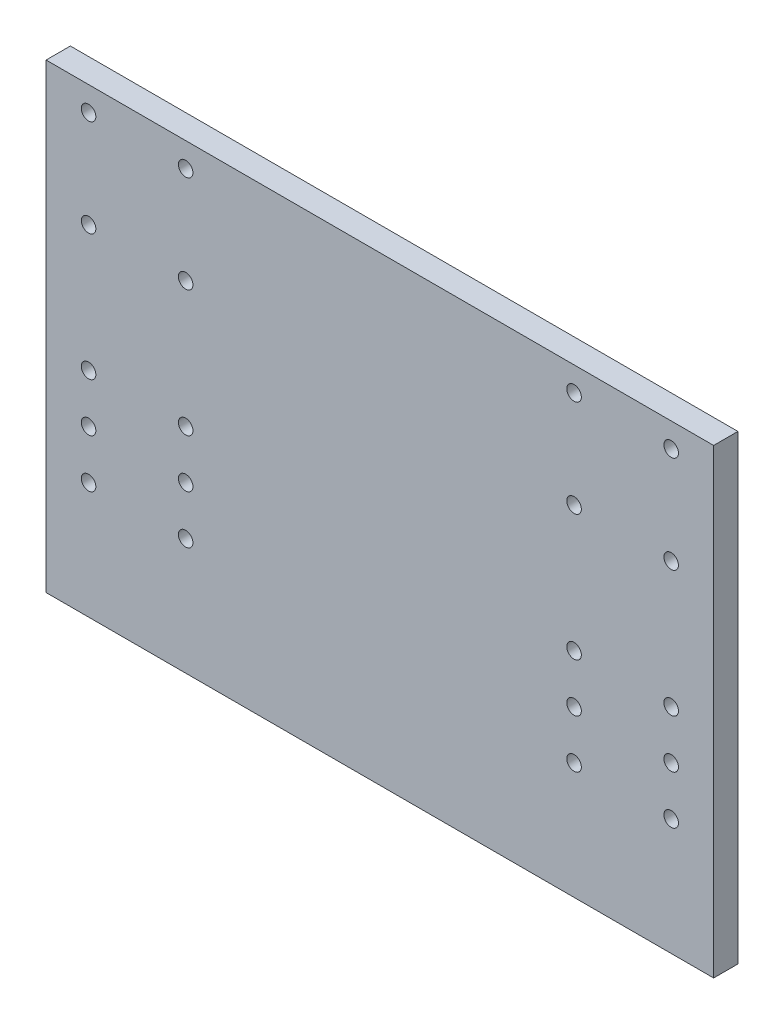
SolidWorks part; units mm, degrees
ref_plane "Спереди" through (0, 0, 0) normal (0, 0, 1) x (1, 0, 0)
ref_plane "Сверху" through (0, 0, 0) normal (0, 1, 0) x (1, 0, 0)
ref_plane "Справа" through (0, 0, 0) normal (1, 0, 0) x (0, 0, -1)
sketch "Эскиз1" plane through (0, 0, 0) normal (0, 0, 1) x (1, 0, 0)
  line L1 (137.5, -95) -> (-137.5, -95)
  line L2 (137.5, -95) -> (137.5, 95)
  line L3 (137.5, 95) -> (-137.5, 95)
  line L4 (-137.5, -95) -> (-137.5, 95)
  line L5 (137.5, -95) -> (-137.5, 95) construction
  line L6 (137.5, 95) -> (-137.5, -95) construction
  point P0 (0, 0)
  dimension "D1" = 190
  dimension "D2" = 275
extrude "Бобышка-Вытянуть1" add sketch "Эскиз1" along normal blind 10
sketch "Эскиз2" plane through (0, 0, 10) normal (0, 0, 1) x (1, 0, 0)
  line L0 (-137.5, -95) -> (137.5, -95) construction
  line L3 (137.5, 95) -> (-137.5, 95) construction
  circle A0 centre (-120, -47) radius 3
  circle A1 centre (-120, -27) radius 3
  circle A2 centre (-80, -27) radius 3
  circle A3 centre (-80, -47) radius 3
  circle A4 centre (80, -47) radius 3
  circle A5 centre (80, -27) radius 3
  circle A6 centre (120, -27) radius 3
  circle A7 centre (120, -47) radius 3
  circle A8 centre (120, 85) radius 3
  circle A9 centre (120, 45) radius 3
  circle A10 centre (80, 45) radius 3
  circle A11 centre (80, 85) radius 3
  circle A12 centre (-80, 85) radius 3
  circle A13 centre (-80, 45) radius 3
  circle A14 centre (-120, 45) radius 3
  circle A15 centre (-120, 85) radius 3
  circle A16 centre (-120, -7) radius 3
  circle A17 centre (-80, -7) radius 3
  circle A18 centre (80, -7) radius 3
  circle A19 centre (120, -7) radius 3
  point P15 (0, 0)
  point P43 (0, 0)
  point P44 (0, 0)
  point P45 (0, 0)
  point P50 (0, 0)
  point P51 (0, 0)
  point P52 (0, 0)
  point P53 (0, 0)
  point P54 (0, 0)
  point P55 (0, 0)
  point P58 (-287.4499, 3.4143)
  dimension "D1" = 40
  dimension "D6" = 6
  dimension "D2" = 40
  dimension "D3" = 20
  dimension "D4" = 120
  dimension "D5" = 48
  dimension "D7" = 10
  dimension "D8" = 40
extrude "Вырез-Вытянуть1" cut sketch "Эскиз2" against normal blind 10
